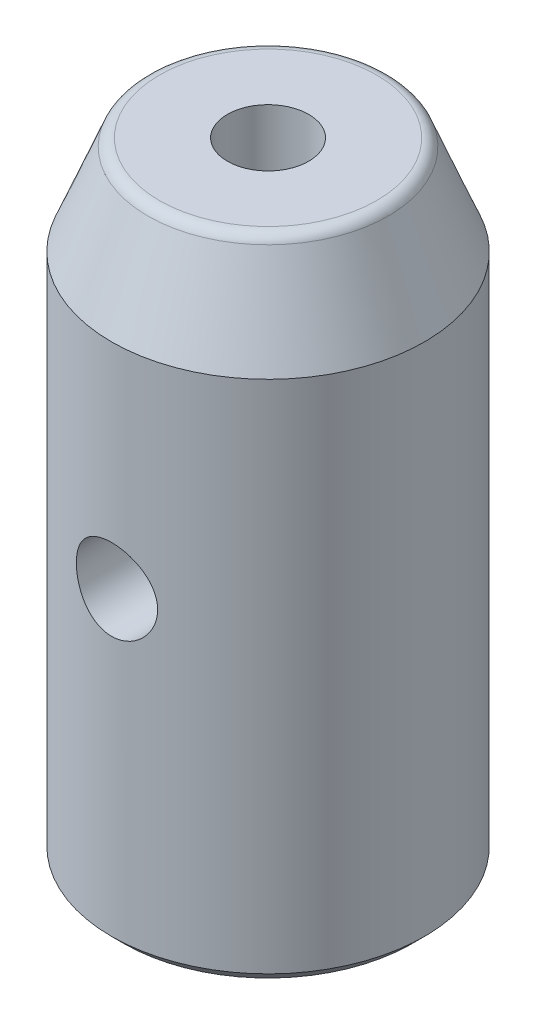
SolidWorks part; units mm, degrees
ref_plane "前基準面" through (0, 0, 0) normal (0, 0, 1) x (1, 0, 0)
ref_plane "上基準面" through (0, 0, 0) normal (0, 1, 0) x (1, 0, 0)
ref_plane "右基準面" through (0, 0, 0) normal (1, 0, 0) x (0, 0, -1)
sketch "草圖1" plane through (0, 0, 0) normal (0, 1, 0) x (1, 0, 0)
  circle A0 centre (0, 0) radius 6.35
  dimension "D1" = 12.7
extrude "填料-伸長1" add sketch "草圖1" along normal blind 25.4
hole_wizard "M4x0.7 螺紋孔1" positions "草圖3" profile "草圖2" tap size "M4x0.7" standard "Ansi Metric"
sketch "草圖3" plane through (0, 25.4, 0) normal (0, 1, 0) x (1, 0, 0)
  point P0 (0, 0)
sketch "草圖2" plane through (0, 25.4, 0) normal (1, 0, 0) x (0, 0, 1)
  line L0 (0, 0) -> (0, 11.0914)
  line L1 (0, 11.0914) -> (1.65, 10.1)
  line L2 (1.65, 10.1) -> (1.65, 0)
  line L5 (1.65, 0) -> (0, 0)
  line L10 (0, 11.0914) -> (-1.65, 10.1) construction
  line L11 (0, -6.35) -> (0, 107.95) construction
  dimension "螺孔鑽直徑" = 3.3
  dimension "螺孔鑽深度" = 10.1
  dimension "導頭角度" = 118
hole_wizard "M6x1.0 螺紋孔1" positions "草圖5" profile "草圖4" tap size "M6x1.0" standard "Ansi Metric"
sketch "草圖5" plane through (0, 0, 0) normal (0, -1, 0) x (-1, 0, 0)
  point P0 (0, 0)
sketch "草圖4" plane through (0, 0, 0) normal (1, 0, 0) x (0, 0, -1)
  line L0 (0, 0) -> (0, 12.5022)
  line L1 (0, 12.5022) -> (2.5, 11)
  line L2 (2.5, 11) -> (2.5, 0)
  line L5 (2.5, 0) -> (0, 0)
  line L10 (0, 12.5022) -> (-2.5, 11) construction
  line L11 (0, -6.35) -> (0, 107.95) construction
  dimension "螺孔鑽直徑" = 5
  dimension "螺孔鑽深度" = 11
  dimension "導頭角度" = 118
chamfer "導角1" distance 4 distance2 1.6 1 edges at (0, 25.4, 6.35)
fillet "圓角1" radius 0.5 1 edges at (0, 25.4, 4.75)
chamfer "導角2" distance 0.5 angle 45 1 edges at (0, 0, 6.35)
ref_plane "平面1" through (0, 0, 6.35) normal (0, 0, 1) x (1, 0, 0)
sketch "草圖6" plane through (0, 0, 6.35) normal (0, 0, 1) x (1, 0, 0)
  line L0 (1.65, 25.4) -> (-1.65, 25.4) construction
  circle A0 centre (0, 12.7) radius 1.65
  dimension "D2" = 3.3
  dimension "D1" = 12.7
extrude "除料-伸長1" cut sketch "草圖6" against normal through all
